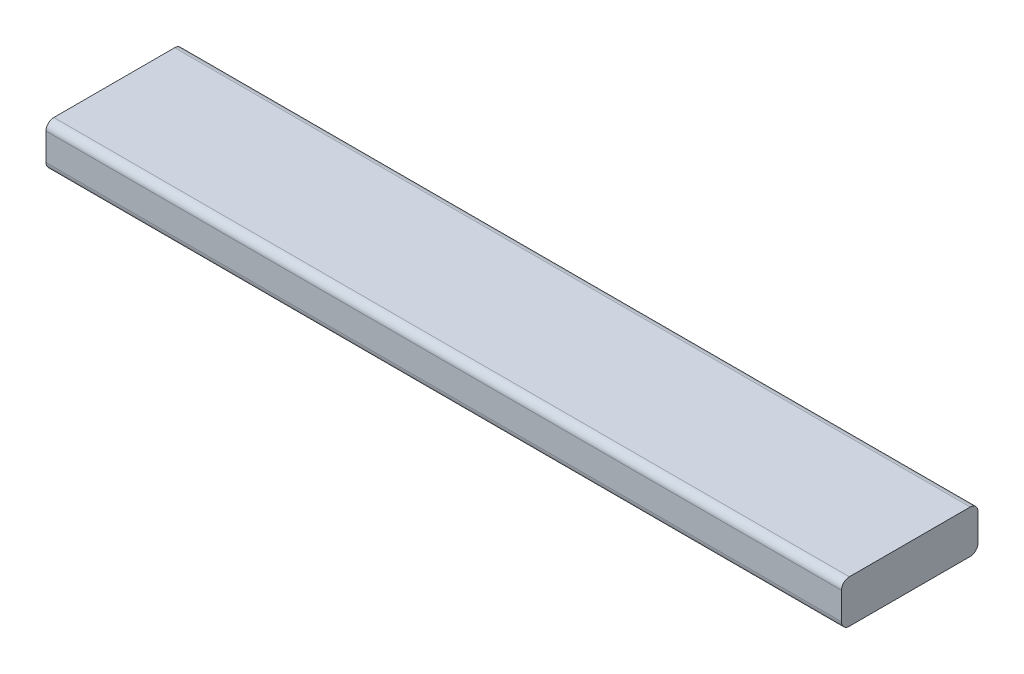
SolidWorks part; units mm, degrees
ref_plane "Bottom Plane" through (0, 0, 0) normal (0, 0, 1) x (1, 0, 0)
ref_plane "Front Plane" through (0, 0, 0) normal (0, 1, 0) x (1, 0, 0)
ref_plane "Left Plane" through (0, 0, 0) normal (1, 0, 0) x (0, 0, -1)
ref_plane "Right Plane" through (647.7, 0, 0) normal (1, 0, 0) x (0, 0, -1)
ref_plane "Back Plane" through (0, 19.05, 0) normal (0, 1, 0) x (1, 0, 0)
ref_plane "Top Plane" through (0, 0, 139.7) normal (0, 0, 1) x (1, 0, 0)
sketch "Sketch2" plane through (0, 0, 0) normal (1, 0, 0) x (0, 0, -1)
  line L1 (0, 0) -> (-111.125, 0)
  line L2 (0, 0) -> (0, 34.925)
  line L3 (0, 34.925) -> (-111.125, 34.925)
  line L4 (-111.125, 0) -> (-111.125, 34.925)
  dimension "D1" = 34.925
  dimension "D2" = 111.125
extrude "Boss-Extrude1" add sketch "Sketch2" along normal up to surface (647.7 mm away)
ref_plane "half length" through (323.85, 0, 0) normal (1, 0, 0) x (0, 0, -1)
ref_plane "Half Width" through (0, 0, 69.85) normal (0, 0, 1) x (1, 0, 0)
fillet "Fillet1" radius 6.35 4 edges at (323.85, 34.925, 111.125) (323.85, 34.925, 0) (323.85, 0, 0) (323.85, 0, 111.125)
